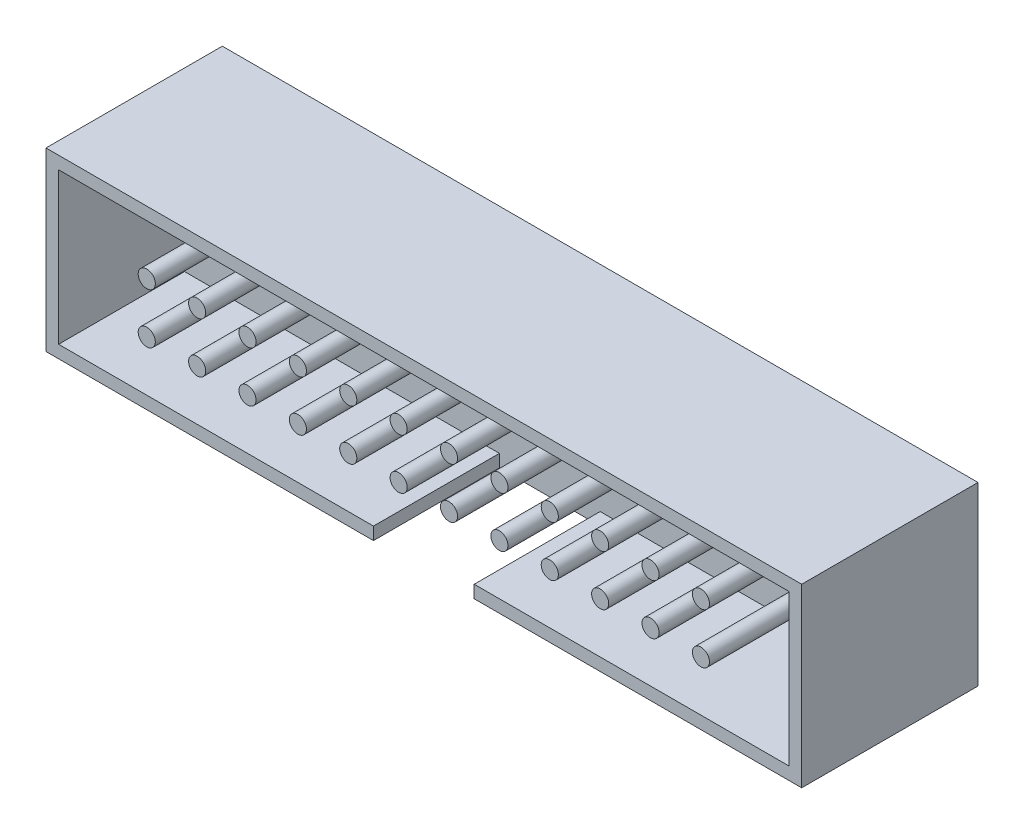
SolidWorks part; units mm, degrees
ref_plane "Front Plane" through (0, 0, 0) normal (0, 0, 1) x (1, 0, 0)
ref_plane "Top Plane" through (0, 0, 0) normal (0, 1, 0) x (1, 0, 0)
ref_plane "Right Plane" through (0, 0, 0) normal (1, 0, 0) x (0, 0, -1)
sketch "Sketch1" plane through (0, 0, 0) normal (0, 0, 1) x (1, 0, 0)
  line L1 (-5.08, 5.715) -> (33.02, 5.715)
  line L2 (-5.08, 5.715) -> (-5.08, -3.175)
  line L3 (-5.08, -3.175) -> (33.02, -3.175)
  line L4 (33.02, 5.715) -> (33.02, -3.175)
extrude "Boss-Extrude1" add sketch "Sketch1" along normal blind 2.54
sketch "Sketch4" plane through (0, 0, 2.54) normal (0, 0, 1) x (1, 0, 0)
  line L0 (-5.08, -3.175) -> (33.02, -3.175) construction
  line L1 (-5.08, 5.715) -> (-4.445, 5.715)
  line L2 (-5.08, 5.715) -> (-5.08, -3.175)
  line L3 (-5.08, -3.175) -> (-4.445, -3.175)
  line L4 (-4.445, 5.715) -> (-4.445, -3.175)
  line L6 (33.02, 5.715) -> (32.385, 5.715)
  line L7 (33.02, 5.715) -> (33.02, -3.175)
  line L8 (33.02, -3.175) -> (32.385, -3.175)
  line L9 (32.385, 5.715) -> (32.385, -3.175)
extrude "Boss-Extrude2" add sketch "Sketch4" along normal blind 6.35
sketch "Sketch5" plane through (0, 0, 2.54) normal (0, 0, 1) x (1, 0, 0)
  line L0 (32.385, 5.715) -> (32.385, -3.175) construction
  line L1 (-4.445, 5.715) -> (32.385, 5.715)
  line L2 (-4.445, 5.715) -> (-4.445, 5.08)
  line L3 (-4.445, 5.08) -> (32.385, 5.08)
  line L4 (32.385, 5.715) -> (32.385, 5.08)
  line L6 (-4.445, -3.175) -> (11.43, -3.175)
  line L7 (-4.445, -3.175) -> (-4.445, -2.54)
  line L8 (-4.445, -2.54) -> (11.43, -2.54)
  line L9 (11.43, -3.175) -> (11.43, -2.54)
  line L10 (32.385, -3.175) -> (16.51, -3.175)
  line L11 (32.385, -3.175) -> (32.385, -2.54)
  line L12 (32.385, -2.54) -> (16.51, -2.54)
  line L13 (16.51, -3.175) -> (16.51, -2.54)
extrude "Boss-Extrude3" add sketch "Sketch5" along normal blind 6.35
sketch "Sketch6" plane through (0, 0, 0) normal (0, 0, -1) x (-1, 0, 0)
  circle A0 centre (0, 0) radius 0.4318
  circle A1 centre (0, 2.54) radius 0.4318
  circle A2 centre (-2.54, 0) radius 0.4318
  circle A3 centre (-5.08, 0) radius 0.4318
  circle A4 centre (-7.62, 0) radius 0.4318
  circle A5 centre (-10.16, 0) radius 0.4318
  circle A6 centre (-12.7, 0) radius 0.4318
  circle A7 centre (-15.24, 0) radius 0.4318
  circle A8 centre (-17.78, 0) radius 0.4318
  circle A9 centre (-20.32, 0) radius 0.4318
  circle A10 centre (-22.86, 0) radius 0.4318
  circle A11 centre (-25.4, 0) radius 0.4318
  circle A12 centre (-27.94, 0) radius 0.4318
  circle A13 centre (-2.54, 2.54) radius 0.4318
  circle A14 centre (-5.08, 2.54) radius 0.4318
  circle A15 centre (-7.62, 2.54) radius 0.4318
  circle A16 centre (-10.16, 2.54) radius 0.4318
  circle A17 centre (-12.7, 2.54) radius 0.4318
  circle A18 centre (-15.24, 2.54) radius 0.4318
  circle A19 centre (-17.78, 2.54) radius 0.4318
  circle A20 centre (-20.32, 2.54) radius 0.4318
  circle A21 centre (-22.86, 2.54) radius 0.4318
  circle A22 centre (-25.4, 2.54) radius 0.4318
  circle A23 centre (-27.94, 2.54) radius 0.4318
extrude "Boss-Extrude4" add sketch "Sketch6" along normal blind 2.54 and the other way blind 8.89 separate body
